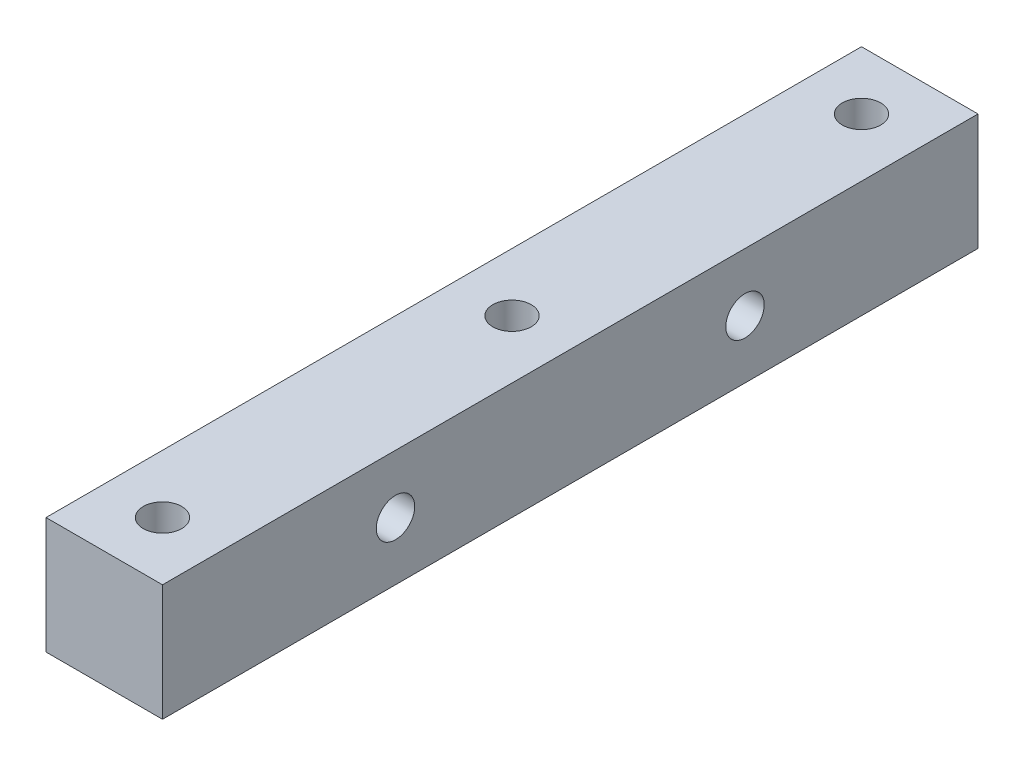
SolidWorks part; units mm, degrees
ref_plane "前视基准面" through (0, 0, 0) normal (0, 0, 1) x (1, 0, 0)
ref_plane "上视基准面" through (0, 0, 0) normal (0, 1, 0) x (1, 0, 0)
ref_plane "右视基准面" through (0, 0, 0) normal (1, 0, 0) x (0, 0, -1)
other "Configuration Table"
sketch "草图1" plane through (0, 0, 0) normal (0, 0, 1) x (1, 0, 0)
  line L1 (-5, 5) -> (5, 5)
  line L2 (-5, 5) -> (-5, -5)
  line L3 (-5, -5) -> (5, -5)
  line L4 (5, 5) -> (5, -5)
  line L5 (-5, 5) -> (5, -5) construction
  line L6 (-5, -5) -> (5, 5) construction
  point P0 (0, 0)
  dimension "D1" = 10
  dimension "D2" = 10
extrude "凸台-拉伸1" add sketch "草图1" along normal blind 70
hole_wizard "M4 螺纹孔1" positions "草图2" profile "草图3" tap size "M4" standard "GB"
sketch "草图2" plane through (0, 5, 0) normal (0, 1, 0) x (1, 0, 0)
  line L0 (5, -70) -> (-5, -70) construction
  line L1 (5, 0) -> (-5, 0) construction
  point P0 (0, -5)
  point P2 (0, -35)
  point P4 (0, -65)
  dimension "D1" = 5
  dimension "D2" = 5
  dimension "D3" = 30
sketch "草图3" plane through (0, 5, 5) normal (1, 0, 0) x (0, 0, 1)
  line L0 (0, 0) -> (0, 10)
  line L1 (0, 10) -> (1.65, 10)
  line L2 (1.65, 10) -> (1.65, 0)
  line L5 (1.65, 0) -> (0, 0)
  line L11 (0, -6.35) -> (0, 107.95) construction
  dimension "通孔螺纹孔钻头直径" = 3.3
  dimension "通孔螺纹孔钻头深度" = 10
hole_wizard "M4 螺纹孔2" positions "草图4" profile "草图5" tap size "M4" standard "GB"
sketch "草图4" plane through (5, 0, 0) normal (1, 0, 0) x (0, 0, -1)
  line L0 (0, -5) -> (0, 5) construction
  line L1 (-70, -5) -> (-70, 5) construction
  line L2 (-70, 5) -> (0, 5) construction
  point P0 (-50, 0)
  point P2 (-20, 0)
  dimension "D1" = 20
  dimension "D2" = 20
  dimension "D3" = 5
  dimension "D4" = 5
sketch "草图5" plane through (5, 0, 50) normal (0, 1, 0) x (0, 0, -1)
  line L0 (0, 0) -> (0, 10)
  line L1 (0, 10) -> (1.65, 10)
  line L2 (1.65, 10) -> (1.65, 0)
  line L5 (1.65, 0) -> (0, 0)
  line L11 (0, -6.35) -> (0, 107.95) construction
  dimension "通孔螺纹孔钻头直径" = 3.3
  dimension "通孔螺纹孔钻头深度" = 10
